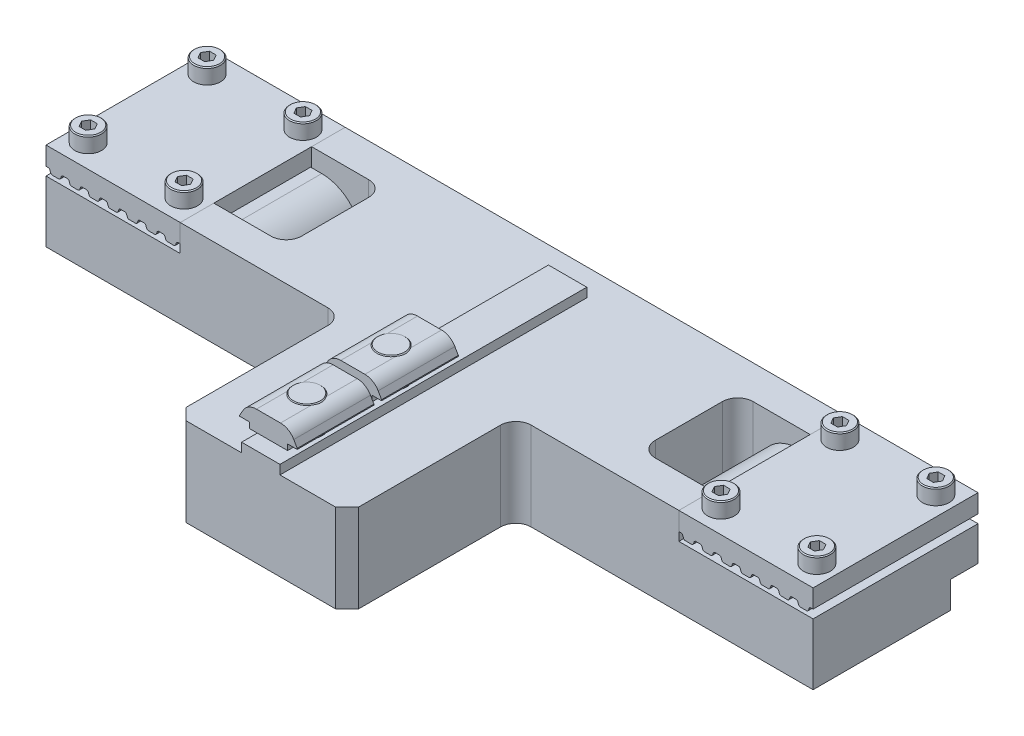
SolidWorks part; units mm, degrees
ref_plane "Front Plane" through (0, 0, 0) normal (0, 0, 1) x (1, 0, 0)
ref_plane "Top Plane" through (0, 0, 0) normal (0, 1, 0) x (1, 0, 0)
ref_plane "Right Plane" through (0, 0, 0) normal (1, 0, 0) x (0, 0, -1)
imported_body "P-00471-1-solid1"
imported_body "P-00473-1-solid1"
imported_body "P-00473-2-solid1"
imported_body "Clamped Belt^Grip Assembly-1-solid1"
imported_body "Clamped Belt^Grip Assembly-2-solid1"
imported_body "LIB M4 SS SHCS-1-solid1"
imported_body "LIB M4 SS SHCS-2-solid1"
imported_body "LIB M4 SS SHCS-3-solid1"
imported_body "LIB M4 SS SHCS-4-solid1"
imported_body "LIB M4 SS SHCS-5-solid1"
imported_body "LIB M4 SS SHCS-6-solid1"
imported_body "LIB M4 SS SHCS-7-solid1"
imported_body "LIB M4 SS SHCS-8-solid1"
imported_body "LIB M8 SS SHCS-1-solid1"
imported_body "LIB M8 SS SHCS-2-solid1"
imported_body "LIB BOSCH SLOT NUT 10mm SLOT-1-solid1"
imported_body "LIB BOSCH SLOT NUT 10mm SLOT-2-solid1"
imported_body "P-00474-1-solid1"
imported_body "P-00474-2-solid1"
ref_plane "Plane2" through (0, 0, -1) normal (0, 0, 1) x (1, 0, 0)
split "Split1" bodies to split 105 104 resulting bodies 124 125
